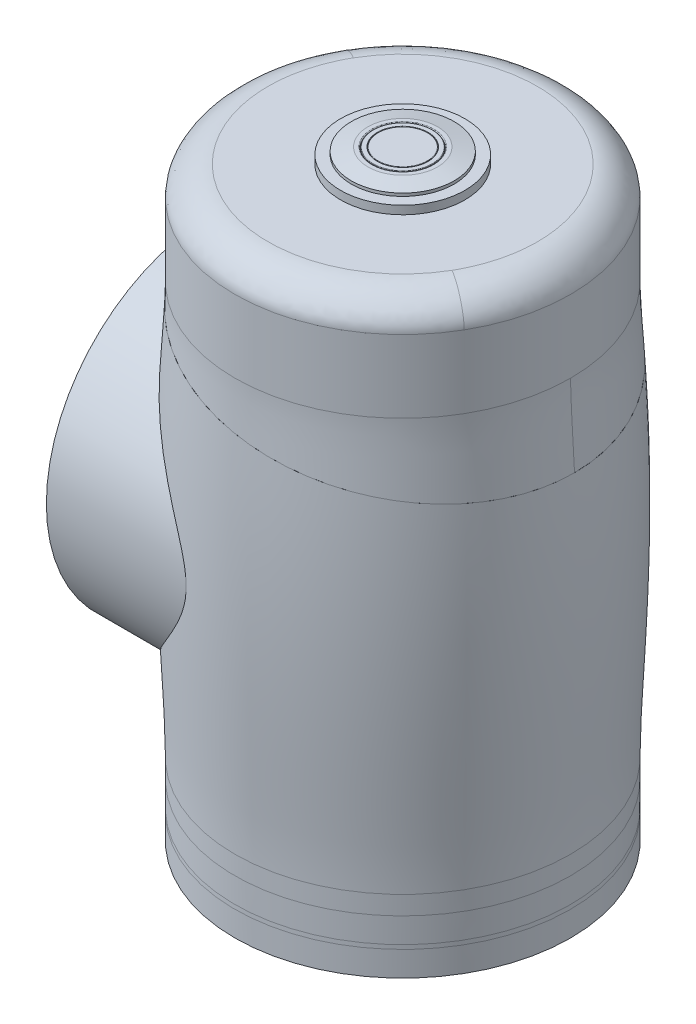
SolidWorks part; units mm, degrees
ref_plane "前视基准面" through (0, 0, 0) normal (0, 0, 1) x (1, 0, 0)
ref_plane "上视基准面" through (0, 0, 0) normal (0, 1, 0) x (1, 0, 0)
ref_plane "右视基准面" through (0, 0, 0) normal (1, 0, 0) x (0, 0, -1)
imported_body "1"
imported_body "2"
sketch "草图1" plane through (-45.5, 0, 0) normal (-1, 0, 0) x (0, 0, 1)
  circle A0 centre (0, 108.5) radius 0.75
  circle A1 centre (0, 68) radius 40.5 construction
  circle A2 centre (0, 68) radius 40.5 construction
  dimension "D1" = 1.5
extrude "切除-拉伸1" cut sketch "草图1" against normal blind 3
ref_plane "基准面1" through (0, 13, 0) normal (0, -1, 0) x (-1, 0, 0)
sketch "草图2" plane through (0, 13, 0) normal (0, -1, 0) x (-1, 0, 0)
  circle A0 centre (40.5, 0) radius 0.75
  circle A1 centre (0, 0) radius 40.5 construction
  circle A2 centre (0, 0) radius 40.5 construction
  dimension "D1" = 1.5
extrude "切除-拉伸2" cut sketch "草图2" against normal blind 3
